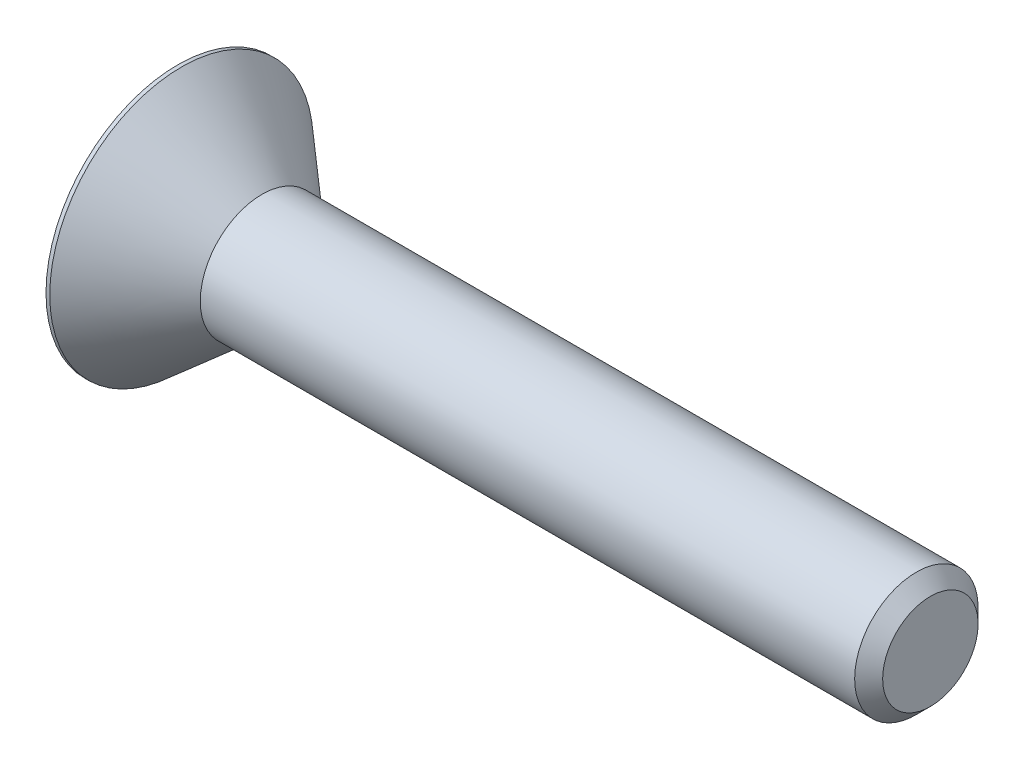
SolidWorks part; units mm, degrees
revolve "PreBroach" cut sketch "Sketch2"
sketch "Sketch2"
  line L0 (0, 1.1938) -> (1.9304, 1.1938)
  line L1 (1.9304, 1.1938) -> (2.6196, 0)
  line L2 (0, 0) -> (127, 0) construction
  line L3 (2.6196, 0) -> (0, 0)
  line L4 (0, 0) -> (0, 1.1938)
  line L5 (0, -1.1938) -> (1.9304, -1.1938) construction
  line L6 (0, 0) -> (47.625, 0) construction
  line L8 (0, 4.445) -> (0, -4.445) construction
revolve "BaseBody" add sketch "BodySke" angle 360 about L6
sketch "BodySke" plane through (0, 0, 0) normal (0, 0, 1) x (1, 0, 0)
  line L0 (0, 0) -> (0, 4.445)
  line L1 (0.127, 4.445) -> (2.8444, 2.0828)
  line L2 (0, 4.445) -> (0.127, 4.445)
  line L3 (2.8444, 2.0828) -> (24.9276, 2.0828)
  line L4 (25.4, 1.6104) -> (25.4, 0)
  line L5 (25.4, 0) -> (0, 0)
  line L6 (0, 0) -> (127, 0) construction
  line L7 (0.127, -4.445) -> (2.8444, -2.0828) construction
  line L8 (25.4, 1.6104) -> (24.9276, 2.0828)
  line L9 (0, -4.445) -> (0.127, -4.445) construction
  line L10 (25.4, -1.6104) -> (24.9276, -2.0828) construction
  line L11 (3.6369, 8.4328) -> (3.6369, -13.7922) construction
  line L12 (0, 19.05) -> (0, -3.175) construction
ref_plane "Plane1" through (0, 0, 0) normal (0, 0, 1) x (1, 0, 0)
ref_plane "Plane2" through (0, 0, 0) normal (0, 1, 0) x (1, 0, 0)
ref_plane "Plane3" through (0, 0, 0) normal (1, 0, 0) x (0, 0, -1)
sketch "Sketch3" plane through (0, 0, 0) normal (-1, 0, 0) x (0, 0, 1)
  line L0 (-1.1938, -0.6892) -> (-1.1938, 0.6892)
  line L1 (-1.1938, 0.6892) -> (0, 1.3785)
  line L2 (0, 1.3785) -> (1.1938, 0.6892)
  line L3 (1.1938, 0.6892) -> (1.1938, -0.6892)
  line L4 (1.1938, -0.6892) -> (0, -1.3785)
  line L5 (0, -1.3785) -> (-1.1938, -0.6892)
extrude "Hex" cut sketch "Sketch3" against normal blind 1.9304
sketch "Sketch4" plane through (0, 0, 0) normal (-1, 0, 0) x (0, 0, 1)
  line L0 (0, 0) -> (1.4605, 0)
  line L1 (0, 0) -> (6.1484, 3.5498) construction
  line L2 (0, 0) -> (0.7302, 1.2648)
  line L3 (1.2009, 0.3267) -> (1.3933, 0.4378)
  line L4 (0.8834, 0.8767) -> (1.0758, 0.9877)
  arc A0 (1.2009, 0.3267) -> (0.8834, 0.8767) centre (0, 0) ccw
  arc A1 (1.4605, 0) -> (1.3933, 0.4378) centre (0, 0) ccw
  arc A2 (0.7302, 1.2648) -> (1.0758, 0.9877) centre (0, 0) cw
extrude "Spline" [suppressed] cut sketch "Sketch4" against normal blind 1.9304
pattern_circular "CirPattern1" [suppressed] count 6 every 60 about axis through (0, 0, 0) along (1, 0, 0)
sketch "ThdSchSke" plane through (0, 0, 0) normal (0, 0, 1) x (1, 0, 0)
  line L0 (3.5099, -1.6104) -> (3.1791, -2.0828)
  line L1 (3.5099, -1.6104) -> (3.8407, -2.0828)
  line L2 (3.8407, -2.0828) -> (3.8407, -2.6035)
  line L3 (-3.175, 0) -> (5.1513, 0) construction
  line L4 (0, 4.445) -> (0, -4.445) construction
  line L5 (3.8407, -2.6035) -> (3.1791, -2.6035)
  line L6 (3.1791, -2.6035) -> (3.1791, -2.0828)
revolve "ThreadSchematic" [suppressed] cut sketch "ThdSchSke" angle 360 about L3
pattern_linear "ThdSchPat" [suppressed]
equation "\"D3@Sketch4\" = \"Spline_p_dim@Sketch4\" / 2"
equation "\"Thread_minor@ThreadCosmetic\"  =  \"Minor_dia@BodySke\""
equation "\"D2@CirPattern1\" = 360 / \"Num_teeth@CirPattern1\""
equation "\"D1@Sketch3\" = \"Hex_size@Sketch3\" / 2"
equation "\"D2@Sketch3\" = \"D1@Sketch3\""
equation "\"D3@Sketch3\" = \"Hex_size@Sketch3\""
equation "\"Thread_length@ThreadCosmetic\" = ((sgn( (\"Length@BodySke\" - \"Advance@BodySke\" - ( ( ( \"Head_dia@BodySke\" - \"Diameter@BodySke\" ) * 0.5 ) / tan( \"Head_ang@BodySke\" * 0.008726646 ) ) ) - \"Thread_nom@Body"
equation "\"Thread_minor@ThdSchSke\" = \"Minor_dia@BodySke\""
equation "\"Diameter@ThdSchSke\" = \"Diameter@BodySke\""
equation "\"Overcut@ThdSchSke\" = \"Diameter@BodySke\" * 1.25"
equation "\"Start@ThdSchSke\" = 0.000001 + \"Length@BodySke\" - \"Thread_length@ThreadCosmetic\"  '---Countersunk---"
equation "\"Num_threads@ThdSchPat\" = int( \"Thread_length@ThreadCosmetic\" / \"Advance@BodySke\" + 0.999 )  + 1"
equation "\"Advance@ThdSchPat\" = \"Thread_length@ThreadCosmetic\" /  (\"Num_threads@ThdSchPat\" - 1) 'relax it"
equation "\"Num_threads@ThdSchPat\" = \"Num_threads@ThdSchPat\" - sgn( \"Num_threads@ThdSchPat\" - 1) '---chamfered tips only---"
